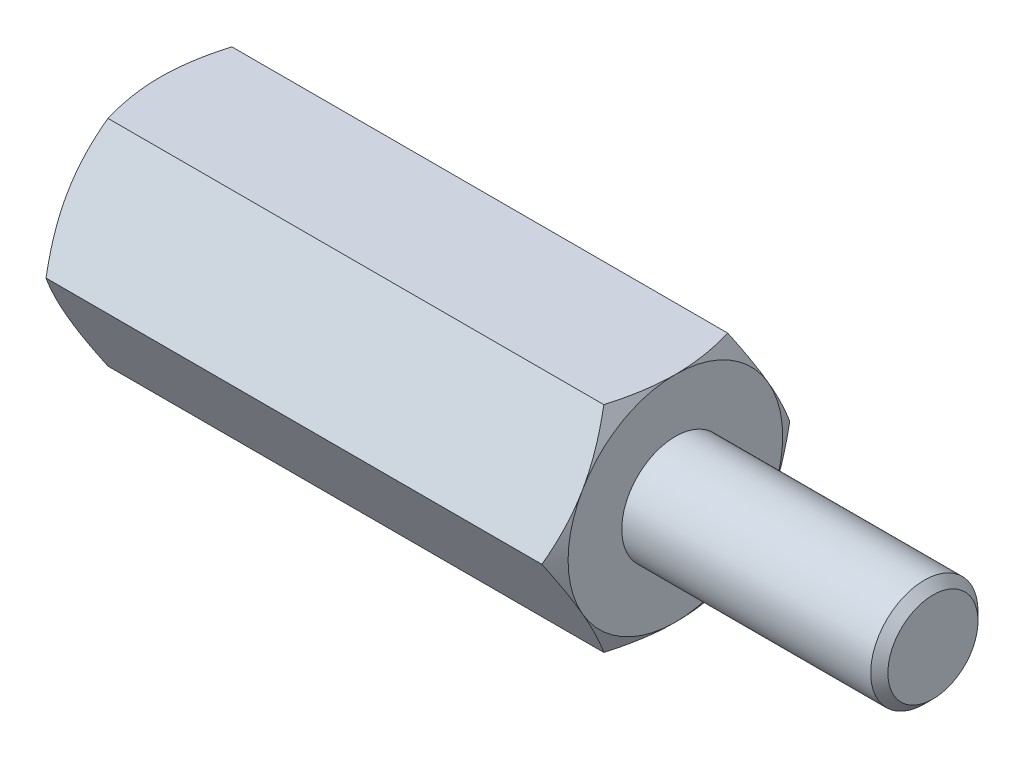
SolidWorks part; units mm, degrees
ref_plane "Front Plane" through (0, 0, 0) normal (0, 0, 1) x (1, 0, 0)
ref_plane "Top Plane" through (0, 0, 0) normal (0, 1, 0) x (1, 0, 0)
ref_plane "Right Plane" through (0, 0, 0) normal (1, 0, 0) x (0, 0, -1)
sketch "Sketch1" plane through (0, 0, 0) normal (1, 0, 0) x (0, 0, -1)
  line L1 (1.4434, 2.5) -> (-1.4434, 2.5)
  line L2 (-1.4434, 2.5) -> (-2.8868, 0)
  line L3 (-2.8868, 0) -> (-1.4434, -2.5)
  line L4 (-1.4434, -2.5) -> (1.4434, -2.5)
  line L5 (1.4434, -2.5) -> (2.8868, 0)
  line L6 (2.8868, 0) -> (1.4434, 2.5)
  circle A0 centre (0, 0) radius 2.5 construction
  dimension "D1" = 5
extrude "Extrude2" add sketch "Sketch1" along normal mid plane 12
sketch "Sketch2" plane through (0, 0, 0) normal (0, 0, 1) x (1, 0, 0)
  line L0 (-6, 2.5) -> (-4.5, 5.0981)
  line L1 (-6, 5.5) -> (-6, 2.5)
  line L3 (0, 0) -> (50000, 0) construction
  arc A0 (-4.5, 5.0981) -> (-6, 5.5) centre (-5.1962, 5.5) ccw
  dimension "D1" = 30
  dimension "D2" = 3
revolve "Cut-Revolve1" cut sketch "Sketch2" angle 360 about L3
mirror "Mirror1" about plane through (0, 0, 0) normal (1, 0, 0) of "Cut-Revolve1"
sketch "Sketch3" plane through (-6, 0, 0) normal (-1, 0, 0) x (0, 0, 1)
  circle A0 centre (0, 0) radius 1.05
  dimension "D1" = 2.1
extrude "Extrude3" cut sketch "Sketch3" against normal blind 6
sketch "Sketch4" plane through (0, 0, 0) normal (0, 0, 1) x (1, 0, 0)
  line L0 (0, 0) -> (0, 1.05)
  line L1 (5.7767, 0) -> (-5.7767, 0) construction
  line L2 (0, 1.05) -> (0.6062, 0)
  line L3 (0.6062, 0) -> (0, 0)
  line L4 (-6, 1.25) -> (-6, -1.25) construction
  point P4 (-6, 0)
  dimension "D1" = 30
  dimension "D2" = 1.05
  dimension "D3" = 6
revolve "Cut-Revolve2" cut sketch "Sketch4" angle 360 about L3
sketch "Sketch5" plane through (6, 0, 0) normal (1, 0, 0) x (0, 0, -1)
  circle A0 centre (0, 0) radius 1.25
  dimension "D1" = 2.5
extrude "Extrude4" add sketch "Sketch5" along normal blind 6
chamfer "Chamfer1" distance 0.2 angle 45 1 edges at (12, 0, -1.25)
equation "\"D2@Sketch4\" = \"D1@Sketch3\"/2"
